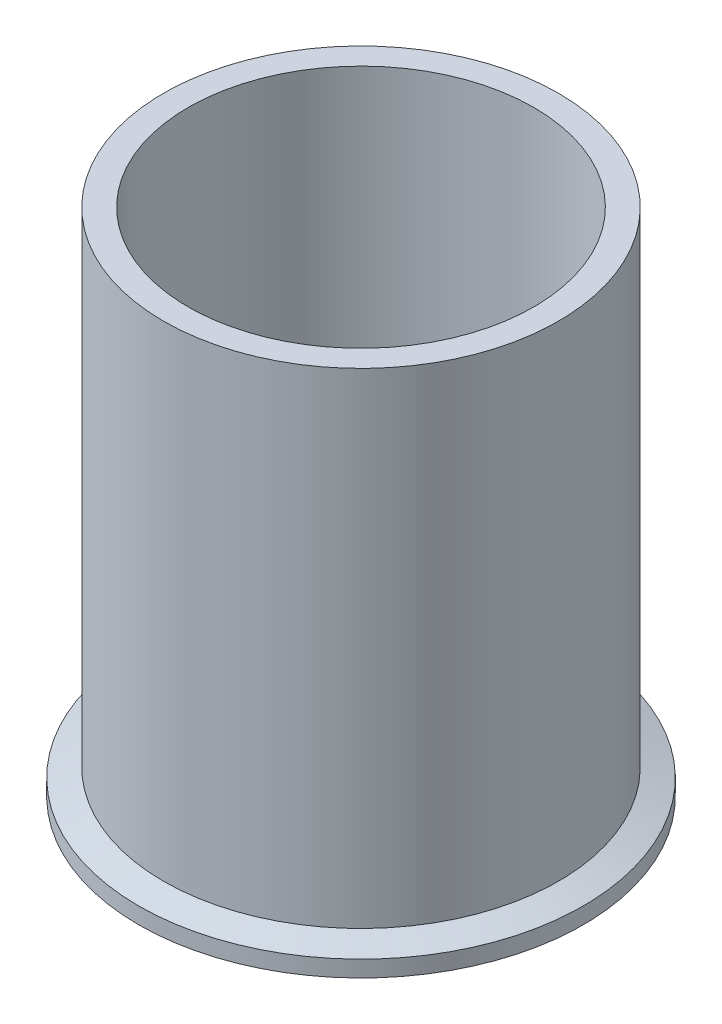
SolidWorks part; units mm, degrees
ref_plane "Front Plane" through (0, 0, 0) normal (0, 0, 1) x (1, 0, 0)
ref_plane "Top Plane" through (0, 0, 0) normal (0, 1, 0) x (1, 0, 0)
ref_plane "Right Plane" through (0, 0, 0) normal (1, 0, 0) x (0, 0, -1)
sketch "Sketch1" plane through (0, 0, 0) normal (0, 0, 1) x (1, 0, 0)
  line L0 (0, 0) -> (0, 88.9) construction
  line L1 (0, 88.9) -> (-34.3916, 88.9)
  line L2 (-34.3916, 88.9) -> (-34.3916, 4.4164)
  line L3 (-34.3916, 4.4164) -> (-38.7096, 2.8448)
  line L4 (-38.7096, 2.8448) -> (-38.7096, 0)
  line L5 (-38.7096, 0) -> (-36.7881, 0)
  line L6 (-33.8556, 0) -> (0, 0)
  line L7 (0, 0) -> (0, 88.9)
  line L8 (0, 88.9) -> (-30.099, 88.9)
  line L9 (-30.099, 88.9) -> (-30.099, 0)
  line L10 (-30.099, 0) -> (0, 0)
  line L11 (0, 0) -> (-0.1846, 0.0129)
  line L12 (-36.7881, 0) -> (-36.4176, 0.8729)
  line L13 (-34.1792, 0.7622) -> (-33.8556, 0)
  line L14 (-35.3187, 0.4064) -> (-35.3187, 2.5172) construction
  arc A0 (-36.4176, 0.8729) -> (-34.1792, 0.7622) centre (-35.3187, 0.4064) cw
  dimension "D6" = 46
  dimension "D7" = 1.1938
  dimension "D5" = 23
  dimension "D1" = 34.3916
  dimension "D2" = 2.8448
  dimension "D3" = 38.7096
  dimension "D4" = 70
  dimension "D8" = 4.2926
  dimension "D9" = 88.9
  dimension "D10" = 0.4064
  dimension "D11" = 35.3187
revolve "Revolve2" add sketch "Sketch1" angle 360 about L0
